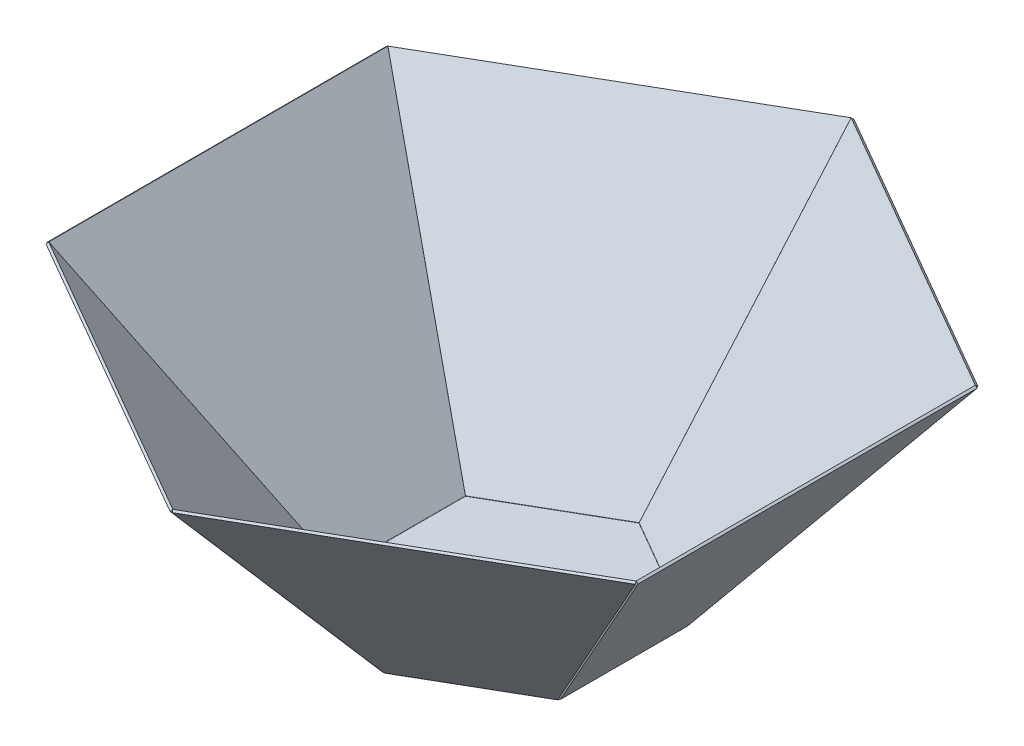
SolidWorks part; units mm, degrees
ref_plane "Ebene vorne" through (0, 0, 0) normal (0, 0, 1) x (1, 0, 0)
ref_plane "Ebene oben" through (0, 0, 0) normal (0, 1, 0) x (1, 0, 0)
ref_plane "Ebene rechts" through (0, 0, 0) normal (1, 0, 0) x (0, 0, -1)
imported_body "Importiert1"
rip "Schlitz1"
sheet metal parameters "Blech1" parameters "D1"=1, "Dicke"=5
bend "Biegung-Winkel6" bend angle 53.13 parameters "D1"=0, "D5"=1
flatten bends "Abwickeln1" parameters "D1"=0
sketch "Skizze-Winkel1" plane through (0, 0, 0) normal (0, -1, 0) x (1, 0, 0)
  line L0 (224.7819, 128.4316) -> (224.7819, -128.4316) construction
  line L1 (1.1659, 258.8826) -> (223.6159, 130.451) construction
  line L2 (-223.6159, 130.451) -> (-1.1659, 258.8826) construction
  line L3 (-224.7819, -128.4316) -> (-224.7819, 128.4316) construction
  line L4 (-1.1659, -258.8826) -> (-223.6159, -130.451) construction
  line L5 (223.6159, -130.451) -> (1.1659, -258.8826) construction
bend "Biegung-Winkel1" bend angle 53.13 parameters "D1"=0, "D5"=6
bend "Biegung-Winkel2" bend angle 53.13 parameters "D1"=0, "D5"=5
bend "Biegung-Winkel3" bend angle 53.13 parameters "D1"=0, "D5"=4
bend "Biegung-Winkel4" bend angle 53.13 parameters "D1"=0, "D5"=3
bend "Biegung-Winkel5" bend angle 53.13 parameters "D1"=0, "D5"=2
process bends "Abbiegen1" parameters "D1"=0
sketch "Abwicklung-Skizze1" plane through (0, 0, 0) normal (0, -1, 0) x (1, 0, 0)
flat pattern "Abwicklung1"
sketch "Biegung-Linien1" plane through (0, 0, 0) normal (0, -1, 0) x (1, 0, 0)
  line L0 (1.8505, -258.4874) -> (222.9314, -130.8463) construction
  line L1 (-1.8505, -258.4874) -> (-222.9314, -130.8463) construction
  line L2 (-224.7819, -127.6411) -> (-224.7819, 127.6411) construction
  line L3 (-222.9314, 130.8463) -> (-1.8505, 258.4874) construction
  line L4 (1.8505, 258.4874) -> (222.9314, 130.8463) construction
  line L5 (224.7819, -127.6411) -> (224.7819, 127.6411) construction
  line L6 (1.8505, -258.4874) -> (222.9314, -130.8463) construction
  line L7 (-1.8505, -258.4874) -> (-222.9314, -130.8463) construction
  line L8 (-224.7819, -127.6411) -> (-224.7819, 127.6411) construction
  line L9 (-222.9314, 130.8463) -> (-1.8505, 258.4874) construction
  line L10 (1.8505, 258.4874) -> (222.9314, 130.8463) construction
  line L11 (224.7819, -127.6411) -> (224.7819, 127.6411) construction
bend of the flat pattern "Abwickeln-<Biegung-Winkel1>1"
bend of the flat pattern "Abwickeln-<Biegung-Winkel2>1"
bend of the flat pattern "Abwickeln-<Biegung-Winkel3>1"
bend of the flat pattern "Abwickeln-<Biegung-Winkel4>1"
bend of the flat pattern "Abwickeln-<Biegung-Winkel5>1"
bend of the flat pattern "Abwickeln-<Biegung-Winkel6>1"
equation "\"LÄNGE\"=0"
equation "\"BREITE\"=0"
equation "\"HÖHE\"=0"
equation "\"DURCHMESSER\"=0"
equation "\"Stückzahl\"= 1"
